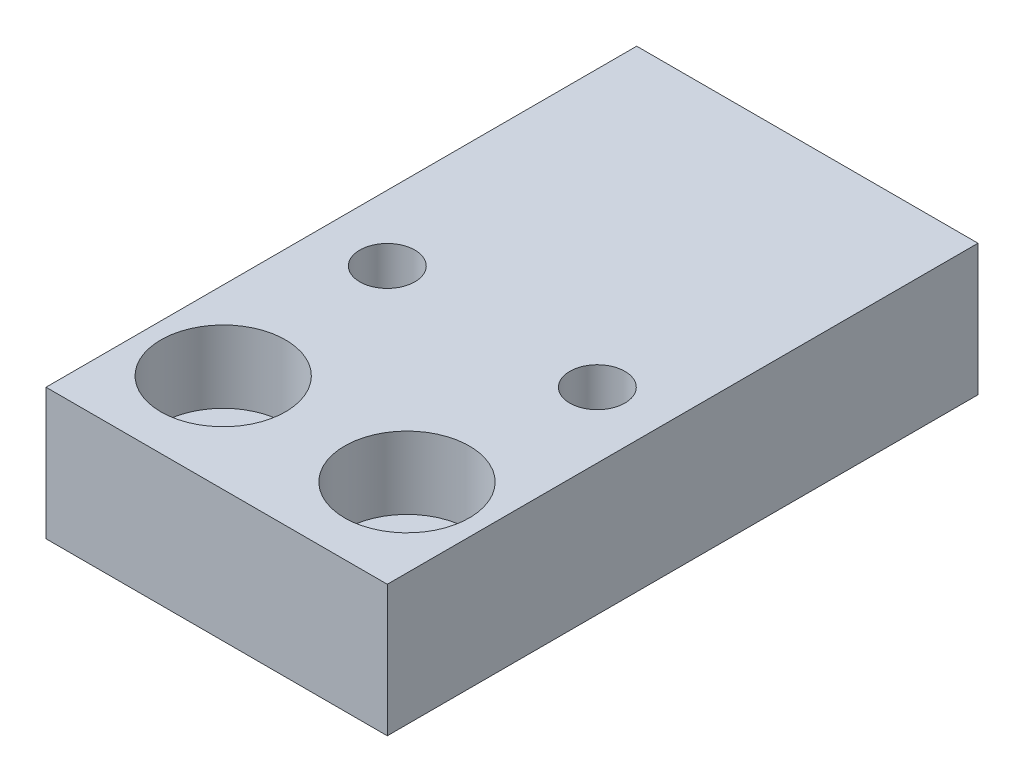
SolidWorks part; units mm, degrees
ref_plane "前视基准面" through (0, 0, 0) normal (0, 0, 1) x (1, 0, 0)
ref_plane "上视基准面" through (0, 0, 0) normal (0, 1, 0) x (1, 0, 0)
ref_plane "右视基准面" through (0, 0, 0) normal (1, 0, 0) x (0, 0, -1)
sketch "草图1" plane through (0, 0, 0) normal (0, 1, 0) x (1, 0, 0)
  line L0 (0, -45) -> (0, 0)
  line L1 (26, -45) -> (26, 0)
  line L2 (0, 0) -> (26, 0)
  line L3 (0, -45) -> (26, -45)
  circle A0 centre (6, -37.5) radius 2.75
  circle A1 centre (20, -37.5) radius 2.75
  circle A2 centre (21, -24) radius 2.1
  circle A3 centre (5, -24) radius 2.1
extrude "凸台-拉伸1" add sketch "草图1" along normal blind 10
sketch "草图2" plane through (0, 10, 0) normal (0, 1, 0) x (1, 0, 0)
  circle A0 centre (6, -37.5) radius 4.75
  circle A1 centre (20, -37.5) radius 4.75
extrude "切除-拉伸1" cut sketch "草图2" against normal blind 5.5
